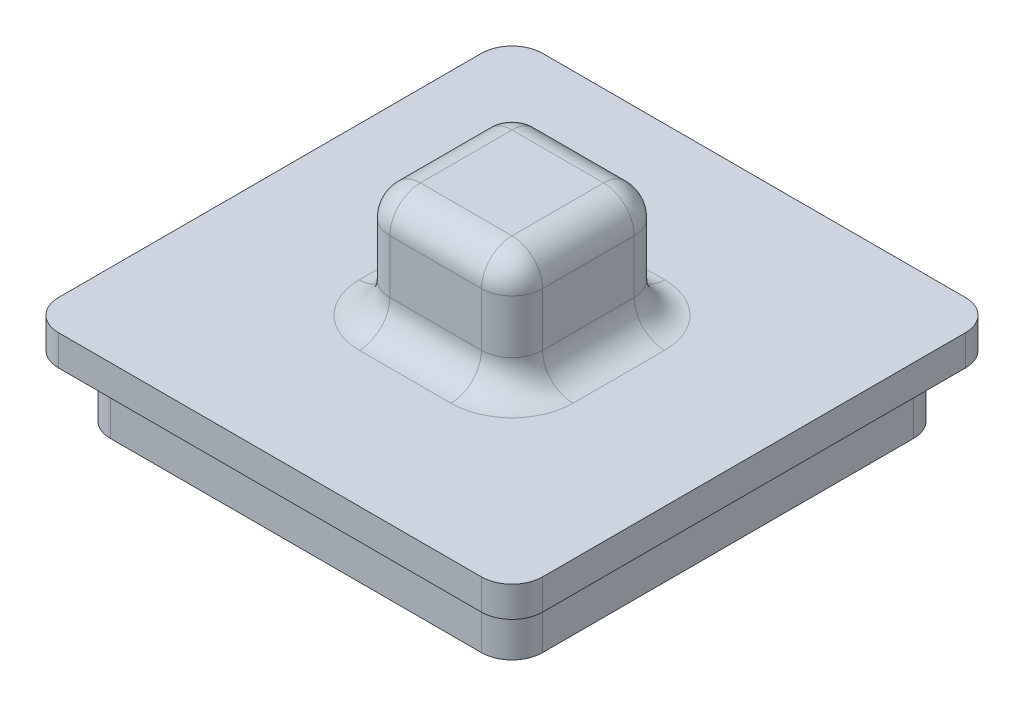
SolidWorks part; units mm, degrees
ref_plane "Front Plane" through (0, 0, 0) normal (0, 0, 1) x (1, 0, 0)
ref_plane "Top Plane" through (0, 0, 0) normal (0, 1, 0) x (1, 0, 0)
ref_plane "Right Plane" through (0, 0, 0) normal (1, 0, 0) x (0, 0, -1)
sketch "Sketch1" plane through (0, 0, 0) normal (0, 1, 0) x (1, 0, 0)
  line L1 (-7.925, 7.925) -> (7.925, 7.925)
  line L2 (-7.925, 7.925) -> (-7.925, -7.925)
  line L3 (-7.925, -7.925) -> (7.925, -7.925)
  line L4 (7.925, 7.925) -> (7.925, -7.925)
  line L5 (-7.925, 7.925) -> (7.925, -7.925) construction
  line L6 (-7.925, -7.925) -> (7.925, 7.925) construction
  point P0 (0, 0)
  dimension "D1" = 15.85
  dimension "D2" = 15.85
extrude "Boss-Extrude1" add sketch "Sketch1" along normal blind 1
sketch "Sketch2" plane through (0, 0, 0) normal (0, -1, 0) x (1, 0, 0)
  line L1 (-7.075, 7.075) -> (7.075, 7.075)
  line L2 (-7.075, 7.075) -> (-7.075, -7.075)
  line L3 (-7.075, -7.075) -> (7.075, -7.075)
  line L4 (7.075, 7.075) -> (7.075, -7.075)
  line L5 (-7.075, 7.075) -> (7.075, -7.075) construction
  line L6 (-7.075, -7.075) -> (7.075, 7.075) construction
  point P0 (0, 0)
  dimension "D1" = 14.15
  dimension "D2" = 14.15
extrude "Boss-Extrude2" add sketch "Sketch2" along normal blind 2
sketch "Sketch3" plane through (0, 1, 0) normal (0, 1, 0) x (1, 0, 0)
  line L1 (-2.5, 2.5) -> (2.5, 2.5)
  line L2 (-2.5, 2.5) -> (-2.5, -2.5)
  line L3 (-2.5, -2.5) -> (2.5, -2.5)
  line L4 (2.5, 2.5) -> (2.5, -2.5)
  line L5 (-2.5, 2.5) -> (2.5, -2.5) construction
  line L6 (-2.5, -2.5) -> (2.5, 2.5) construction
  point P0 (0, 0)
  dimension "D1" = 5
  dimension "D2" = 5
extrude "Boss-Extrude3" add sketch "Sketch3" along normal blind 3.75
fillet "Fillet1" radius 1 20 edges at (0, 1, -2.5) (2.5, 2.875, -2.5) (2.5, 1, 0) (0, 4.75, -2.5) (2.5, 4.75, 0) (0, 4.75, 2.5) (2.5, 2.875, 2.5) (0, 1, 2.5) (-2.5, 2.875, -2.5) (-2.5, 4.75, 0) (-2.5, 2.875, 2.5) (-2.5, 1, 0) (-7.925, 0.5, 7.925) (-7.925, 0.5, -7.925) (7.925, 0.5, -7.925) (7.925, 0.5, 7.925) (-7.075, -1, -7.075) (7.075, -1, -7.075) (7.075, -1, 7.075) (-7.075, -1, 7.075)
